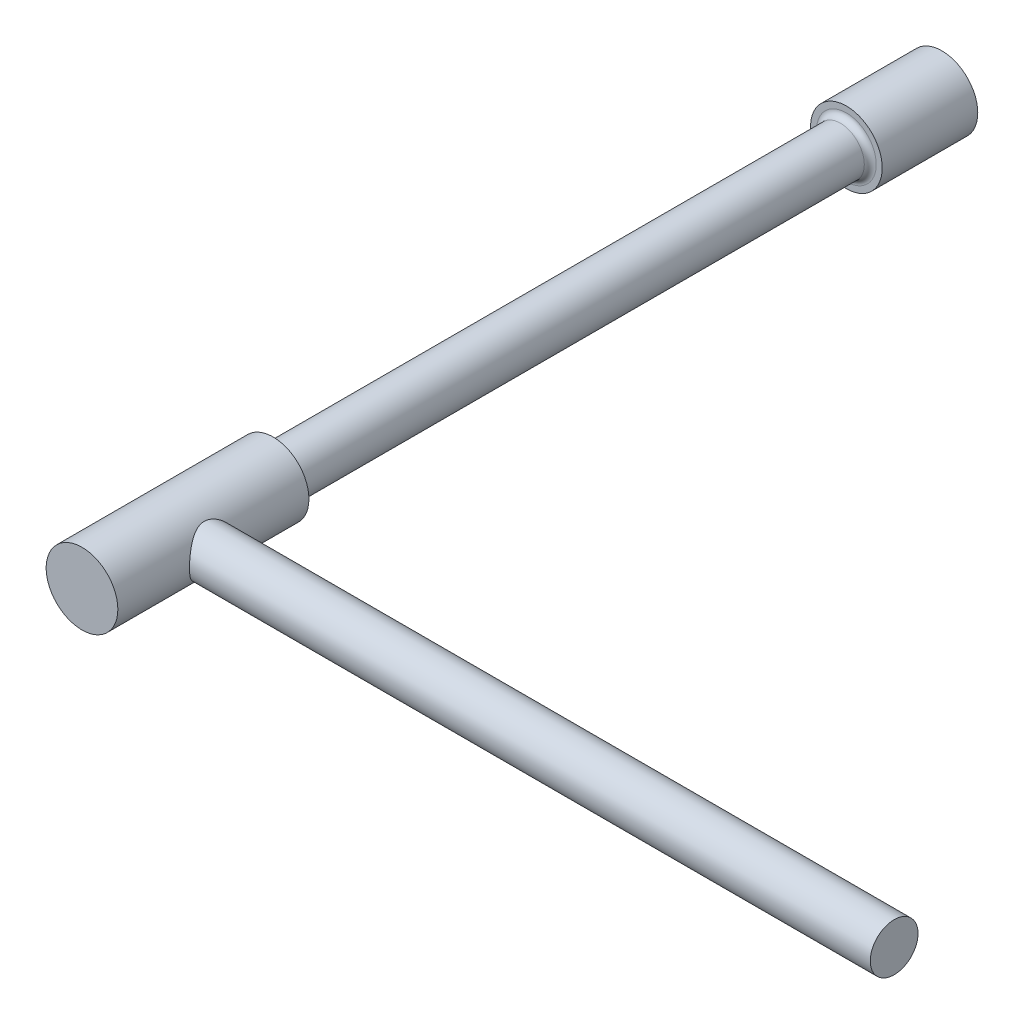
SolidWorks part; units mm, degrees
ref_plane "Alzado" through (0, 0, 0) normal (0, 0, 1) x (1, 0, 0)
ref_plane "Planta" through (0, 0, 0) normal (0, 1, 0) x (1, 0, 0)
ref_plane "Vista lateral" through (0, 0, 0) normal (1, 0, 0) x (0, 0, -1)
sketch "Croquis1" plane through (0, 0, 0) normal (0, 0, 1) x (1, 0, 0)
  circle A0 centre (0, 0) radius 19.05
  dimension "D1" = 38.1
extrude "Saliente-Extruir1" add sketch "Croquis1" along normal blind 50.8
sketch "Croquis2" plane through (0, 0, 0) normal (1, 0, 0) x (0, 0, -1)
  line L0 (-50.8, 0) -> (-53.975, 0)
  line L1 (-50.8, 19.05) -> (-50.8, -19.05) construction
  line L7 (-53.975, 0) -> (-53.975, 12.7)
  line L8 (-53.975, 12.7) -> (-53.975, 15.875) construction
  line L9 (-50.8, 15.875) -> (-50.8, 0)
  arc A1 (-53.975, 12.7) -> (-50.8, 15.875) centre (-53.975, 15.875) ccw
  dimension "D1" = 3.175
  dimension "D2" = 12.7
  dimension "D3" = 3.175
revolve "Revolución2" add sketch "Croquis2" angle 360 about L0
sketch "Croquis4" plane through (0, 0, 53.975) normal (0, 0, 1) x (1, 0, 0)
  circle A0 centre (0, 0) radius 12.7
  dimension "D1" = 25.4
extrude "Saliente-Extruir2" add sketch "Croquis4" along normal blind 301.625
sketch "Croquis5" plane through (0, 0, 355.6) normal (0, 0, 1) x (1, 0, 0)
  circle A0 centre (0, 0) radius 19.05
  dimension "D1" = 38.1
extrude "Saliente-Extruir3" add sketch "Croquis5" along normal blind 101.6
sketch "Croquis6" plane through (0, 0, 0) normal (1, 0, 0) x (0, 0, -1)
  line L0 (0, -19.05) -> (0, 19.05) construction
  circle A0 centre (-406.4, 0) radius 12.7
  dimension "D1" = 25.4
  dimension "D2" = 406.4
extrude "Saliente-Extruir4" add sketch "Croquis6" along normal blind 381
